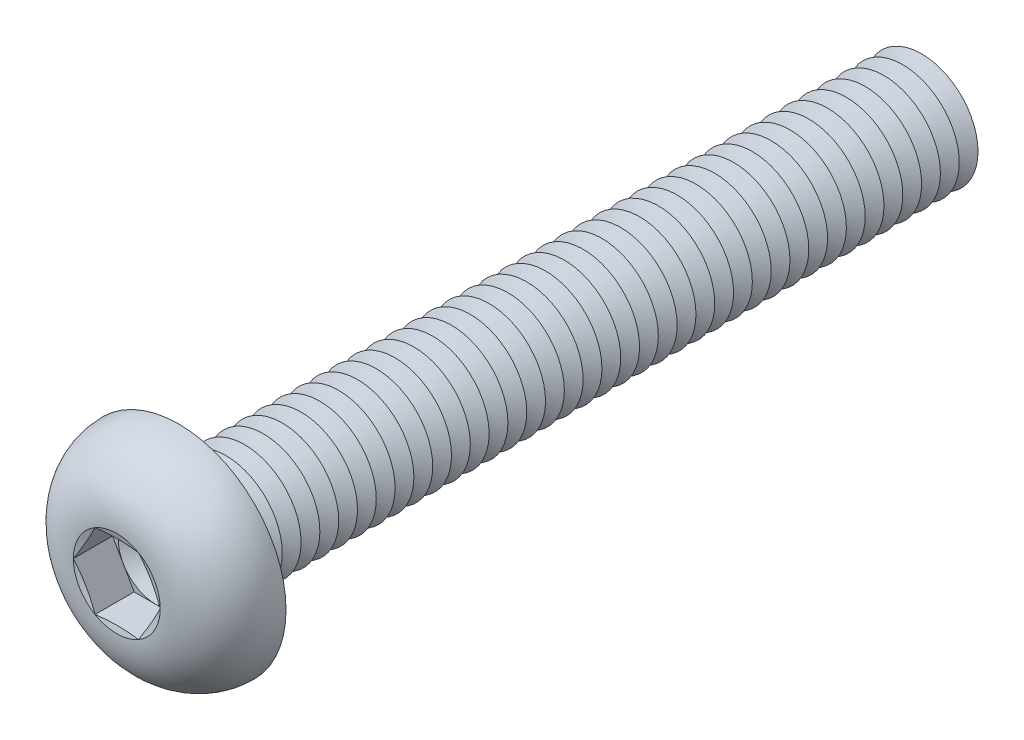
SolidWorks part; units mm, degrees
ref_plane "Front Plane" through (0, 0, 0) normal (0, 0, 1) x (1, 0, 0)
ref_plane "Top Plane" through (0, 0, 0) normal (0, 1, 0) x (1, 0, 0)
ref_plane "Right Plane" through (0, 0, 0) normal (1, 0, 0) x (0, 0, -1)
sketch "Sketch1" plane through (0, 0, 0) normal (1, 0, 0) x (0, 0, -1)
  line L0 (0, 1.5) -> (0, 2.85)
  line L3 (0, 1.5) -> (20, 1.5)
  line L4 (20, 1.5) -> (20, 0)
  line L5 (20, 0) -> (-1.65, 0) construction
  line L6 (-1.65, 0) -> (20, 0)
  line L7 (-1.65, 1.1547) -> (-1.65, 0.5773) construction
  line L8 (-1.65, 0.5773) -> (-1.65, 0)
  line L9 (-1.65, 1.1547) -> (-1.4953, 0.5773)
  line L10 (-1.4953, 0.5773) -> (-1.65, 0.5773)
  line L11 (20, 0) -> (22.7481, 0) construction
  line L12 (0, 2.85) -> (-1.65, 2.85) construction
  arc A1 (0, 2.85) -> (-1.65, 1.1547) centre (0, 1.1994) ccw
  point P8 (20, 0.75)
  dimension "D1" = 5.7
  dimension "D2" = 3
  dimension "D3" = 1.65
  dimension "D4" = 2.3094
  dimension "D5" = 20
  dimension "D6" = 15
revolve "Revolve1" add sketch "Sketch1" angle 360 about L5
fillet "Fillet1" radius 0.25 1 edges at (-1.5, 0, 0)
sketch "Sketch2" plane through (0, 0, 0) normal (1, 0, 0) x (0, 0, -1)
  line L0 (19.75, 1.5) -> (20.25, 1.5)
  line L1 (20, 1.5) -> (0.25, 1.5) construction
  line L2 (20.25, 1.5) -> (20, 1.067)
  line L3 (20, -1.5) -> (20, 1.5) construction
  line L4 (20, 1.067) -> (19.75, 1.5)
  dimension "D1" = 0.5
revolve "Cut-Revolve1" cut sketch "Sketch2" angle 360 about axis through (0, 0, -20) along (0, 0, -1)
pattern_linear "LPattern1" count 40 spacing 0.5 along (0, 0, 1) of "Cut-Revolve1"
sketch "Sketch3" plane through (0, 0, 1.65) normal (0, 0, 1) x (1, 0, 0)
  line L7 (0.5773, 1) -> (-0.5774, 1)
  line L8 (-0.5774, 1) -> (-1.1547, 0)
  line L9 (-1.1547, 0) -> (-0.5773, -1)
  line L10 (-0.5773, -1) -> (0.5773, -1)
  line L11 (0.5773, -1) -> (1.1547, 0)
  line L12 (1.1547, 0) -> (0.5773, 1)
  circle A0 centre (0, 0) radius 1 construction
  circle A3 centre (0, 0) radius 1.1547 construction
extrude "Cut-Extrude1" cut sketch "Sketch3" against normal blind 1.04
sketch "Sketch4" plane through (0, 0, 0.61) normal (0, 0, 1) x (1, 0, 0)
  line L1 (0.5773, 1) -> (-0.5774, 1) construction
  circle A0 centre (0, 0) radius 1
extrude "Cut-Extrude2" cut sketch "Sketch4" against normal through all draft 60
